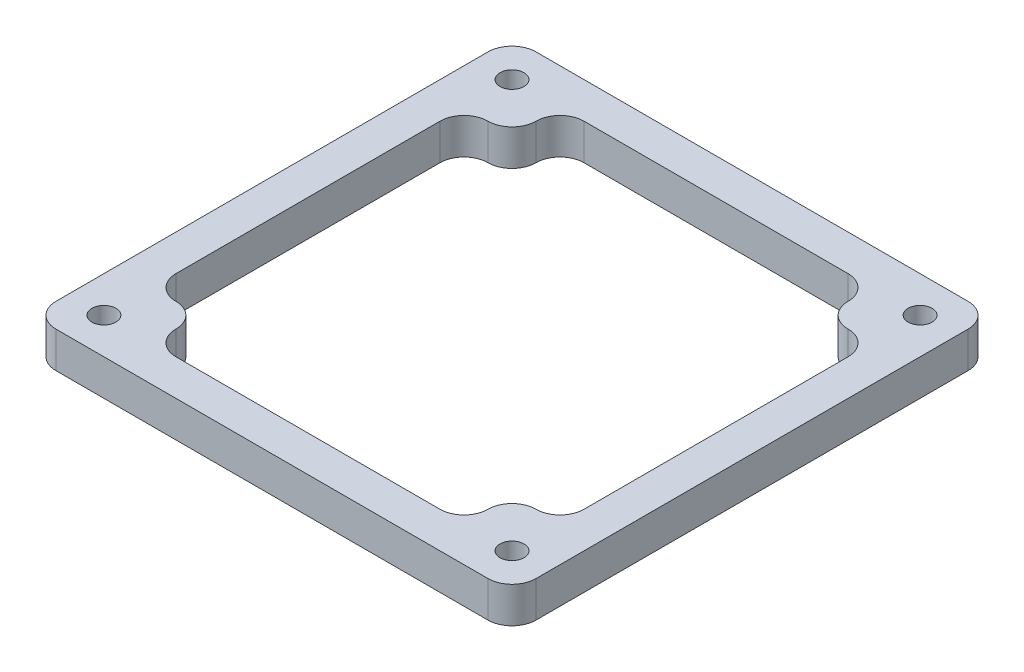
SolidWorks part; units mm, degrees
ref_plane "Front Plane" through (0, 0, 0) normal (0, 0, 1) x (1, 0, 0)
ref_plane "Top Plane" through (0, 0, 0) normal (0, 1, 0) x (1, 0, 0)
ref_plane "Right Plane" through (0, 0, 0) normal (1, 0, 0) x (0, 0, -1)
sketch "Sketch1" plane through (0, 0, 0) normal (0, 1, 0) x (1, 0, 0)
  line L0 (-13, 13) -> (-17, 13)
  line L1 (-20, -20) -> (20, -20)
  line L2 (20, -20) -> (20, 20)
  line L3 (20, 20) -> (-20, 20)
  line L4 (-20, -20) -> (-20, 20)
  line L5 (20, -20) -> (-16.2929, 16.2929) construction
  line L6 (20, 20) -> (-20, -20) construction
  line L8 (13, 17) -> (-13, 17)
  line L11 (13, -13) -> (-13, 13) construction
  line L12 (13, 13) -> (-13, -13) construction
  line L13 (13, -17) -> (-13, -17)
  line L14 (17, -13) -> (17, 13)
  line L16 (-17, -13) -> (-17, 13)
  line L17 (17, -17) -> (-16.2929, 16.2929) construction
  line L18 (17, 17) -> (-17, -17) construction
  line L19 (-13, 13) -> (-13, 17)
  line L20 (13, 13) -> (13, 17)
  line L21 (13, 13) -> (17, 13)
  line L22 (-13, -13) -> (-17, -13)
  line L23 (-13, -13) -> (-13, -17)
  line L24 (13, -13) -> (17, -13)
  line L25 (13, -13) -> (13, -17)
  line L26 (-17, 13) -> (-17, -13) construction
  line L27 (-17, 17) -> (-20, 20) construction
  circle A0 centre (-17, 17) radius 1
  circle A1 centre (17, 17) radius 1
  circle A2 centre (17, -17) radius 1
  circle A3 centre (-17, -17) radius 1
  point P0 (0, 0)
  point P6 (0, 0)
  point P11 (0, 0)
  point P36 (0, -34.9765)
  dimension "D6" = 2
  dimension "D1" = 40
  dimension "D2" = 40
  dimension "D4" = 3
extrude "Boss-Extrude2" add sketch "Sketch1" along normal blind 3
fillet "Fillet1" radius 2 16 edges at (-17, 1.5, -13) (-17, 1.5, 13) (-13, 1.5, 13) (-13, 1.5, 17) (13, 1.5, 17) (13, 1.5, 13) (17, 1.5, 13) (17, 1.5, -13) (13, 1.5, -13) (13, 1.5, -17) (-13, 1.5, -17) (-13, 1.5, -13) (-20, 1.5, -20) (20, 1.5, 20) (-20, 1.5, 20) (20, 1.5, -20)
